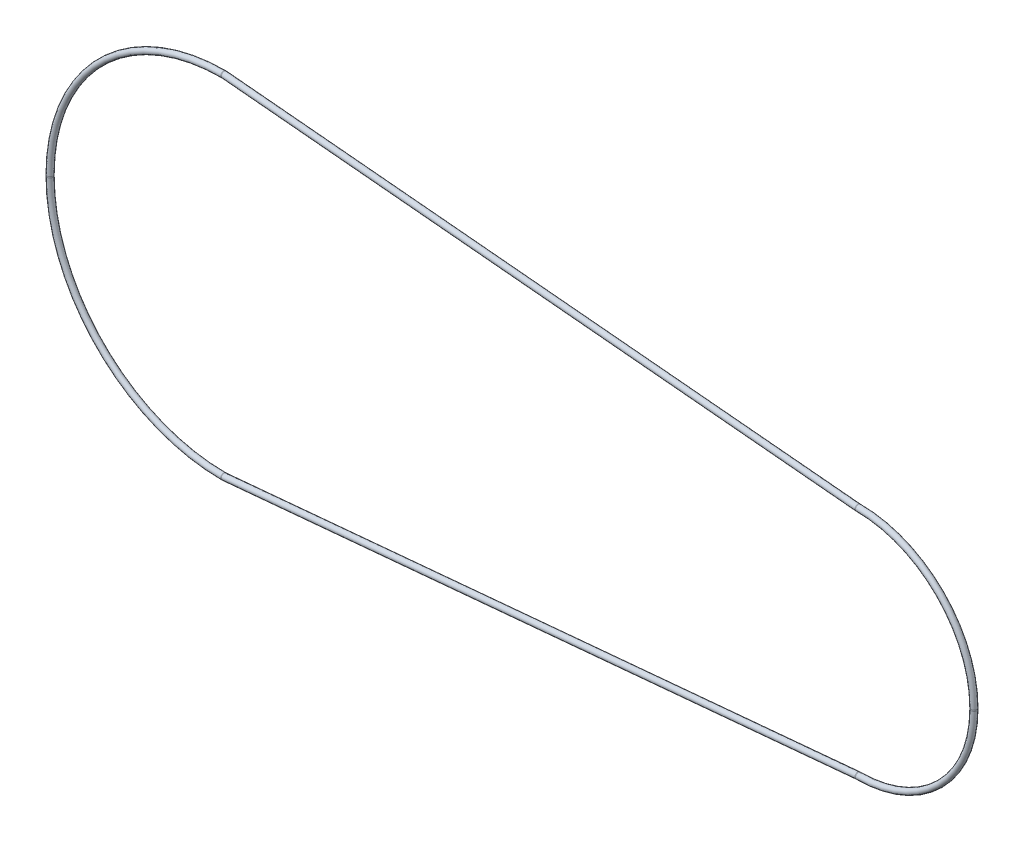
SolidWorks part; units mm, degrees
ref_plane "Plan de face" through (0, 0, 0) normal (0, 0, 1) x (1, 0, 0)
ref_plane "Plan de dessus" through (0, 0, 0) normal (0, 1, 0) x (1, 0, 0)
ref_plane "Plan de droite" through (0, 0, 0) normal (1, 0, 0) x (0, 0, -1)
sketch3d "Esquisse3D1"
  line L0 (-51.995, 31.5005, 9) -> (57.192, 21.5003, 9)
  line L1 (57.192, -18.4982, 9) -> (-51.995, -28.4984, 9)
  line L2 (57.192, 21.5003, 9) -> (57.292, 21.5003, 9)
  line L3 (77.192, 1.6003, 9) -> (77.192, 1.4018, 9)
  line L4 (57.2905, -18.4982, 9) -> (57.192, -18.4982, 9)
  line L5 (-51.995, 31.5005, 9) -> (-52.095, 31.5005, 9)
  line L6 (-81.995, 1.6005, 9) -> (-81.995, 1.4016, 9)
  line L7 (-52.0939, -28.4984, 9) -> (-51.995, -28.4984, 9)
  arc A0 (57.292, 21.5003, 9) -> (77.192, 1.6003, 9) centre (57.292, 1.6003, 9) ccw
  arc A1 (77.192, 1.4018, 9) -> (57.2905, -18.4982, 9) centre (57.292, 1.4018, 9) ccw
  arc A4 (-52.095, 31.5005, 9) -> (-81.995, 1.6005, 9) centre (-52.095, 1.6005, 9) ccw
  arc A5 (-81.995, 1.4016, 9) -> (-52.0939, -28.4984, 9) centre (-52.095, 1.4016, 9) ccw
  point P14 (77.192, 21.5003, 9)
  point P15 (57.292, 1.6003, -10.9)
  point P18 (77.192, -18.4997, 9)
  point P19 (57.292, 1.4018, -10.9)
  point P24 (-81.995, 31.5005, 9)
  point P25 (-52.095, 1.6005, 38.9)
  point P28 (-81.995, -28.4995, 9)
  point P29 (-52.095, 1.4016, 38.9)
  dimension "D4" = 19.9
  dimension "D5" = 19.9
  dimension "D9" = 29.9
  dimension "D10" = 29.9
  dimension "D1" = 20
  dimension "D2" = 20
  dimension "D3" = 40
  dimension "D6" = 30
  dimension "D7" = 60
  dimension "D8" = 30
ref_plane "Plan4" through (-51.995, 31.5005, 9) normal (0.9958, -0.0912, 0) x (0, 0, -1)
sketch "Esquisse8" plane through (-51.995, 31.5005, 9) normal (0.9958, -0.0912, 0) x (0, 0, -1)
  circle A0 centre (0, 0) radius 0.5
  dimension "D1" = 1
sweep "Balayage7" add profiles "Esquisse8" path "Esquisse3D1"
